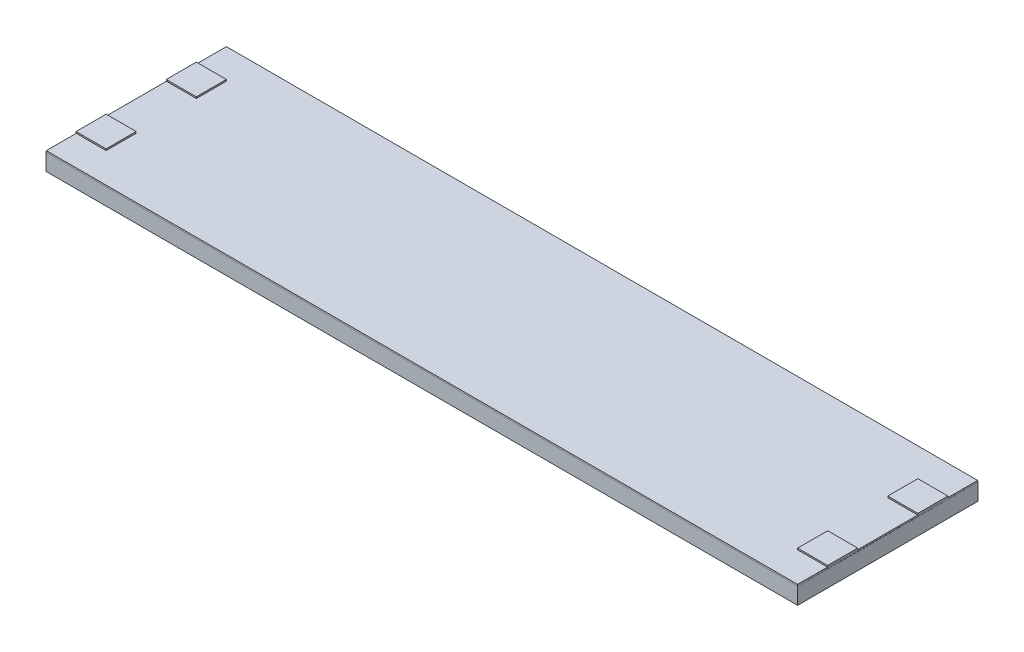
SolidWorks part; units mm, degrees
ref_plane "Front Plane" through (0, 0, 0) normal (0, 0, 1) x (1, 0, 0)
ref_plane "Top Plane" through (0, 0, 0) normal (0, 1, 0) x (1, 0, 0)
ref_plane "Right Plane" through (0, 0, 0) normal (1, 0, 0) x (0, 0, -1)
sketch "Sketch1" plane through (0, 0, 0) normal (0, 1, 0) x (1, 0, 0)
  line L1 (0, 0) -> (50, 0)
  line L2 (0, 0) -> (0, 12)
  line L3 (0, 12) -> (50, 12)
  line L4 (50, 0) -> (50, 12)
  dimension "D1" = 50
  dimension "D2" = 12
extrude "Boss-Extrude1" add sketch "Sketch1" along normal blind 1.1
sketch "Sketch2" plane through (0, 1.1, 0) normal (0, 1, 0) x (1, 0, 0)
  line L0 (0.01, 11.99) -> (0.01, 0.01)
  line L1 (0.01, 0.01) -> (49.99, 0.01)
  line L2 (49.99, 0.01) -> (49.99, 11.99)
  line L3 (49.99, 11.99) -> (0.01, 11.99)
  line L4 (0, 12) -> (0, 0)
  line L5 (0, 0) -> (50, 0)
  line L6 (50, 0) -> (50, 12)
  line L7 (50, 12) -> (0, 12)
  line L8 (0, 12) -> (0, 0)
  line L9 (0, 0) -> (50, 0)
  line L10 (50, 0) -> (50, 12)
  line L11 (50, 12) -> (0, 12)
  dimension "D1" = 0
  dimension "D2" = 0.01
extrude "Boss-Extrude2" add sketch "Sketch2" along normal blind 0.1 contours L2 L3 L0 L1
sketch "Sketch4" plane through (0, 1.2, 0) normal (0, 1, 0) x (1, 0, 0)
  line L0 (0.01, 11.99) -> (0.01, 0.01) construction
  line L1 (2, 10) -> (0, 10)
  line L2 (2, 10) -> (2, 8)
  line L3 (2, 8) -> (0, 8)
  line L4 (0, 10) -> (0, 8)
  line L5 (49.99, 11.99) -> (0.01, 11.99) construction
  line L6 (25, 11.99) -> (25, 0.01) construction
  line L7 (0.01, 0.01) -> (49.99, 0.01) construction
  line L8 (25, 0.01) -> (0.01, 6) construction
  line L9 (0.01, 6) -> (49.99, 6) construction
  line L10 (49.99, 0.01) -> (49.99, 11.99) construction
  line L11 (0, 2) -> (0, 4)
  line L12 (2, 4) -> (0, 4)
  line L13 (2, 2) -> (2, 4)
  line L14 (2, 2) -> (0, 2)
  line L15 (48, 2) -> (50, 2)
  line L16 (48, 2) -> (48, 4)
  line L17 (48, 4) -> (50, 4)
  line L18 (50, 2) -> (50, 4)
  line L19 (50, 10) -> (50, 8)
  line L20 (48, 8) -> (50, 8)
  line L21 (48, 10) -> (48, 8)
  line L22 (48, 10) -> (50, 10)
  dimension "D1" = 0.01
  dimension "D2" = 1.99
  dimension "D3" = 2
  dimension "D4" = 2
extrude "Boss-Extrude4" add sketch "Sketch4" along normal blind 0.1
